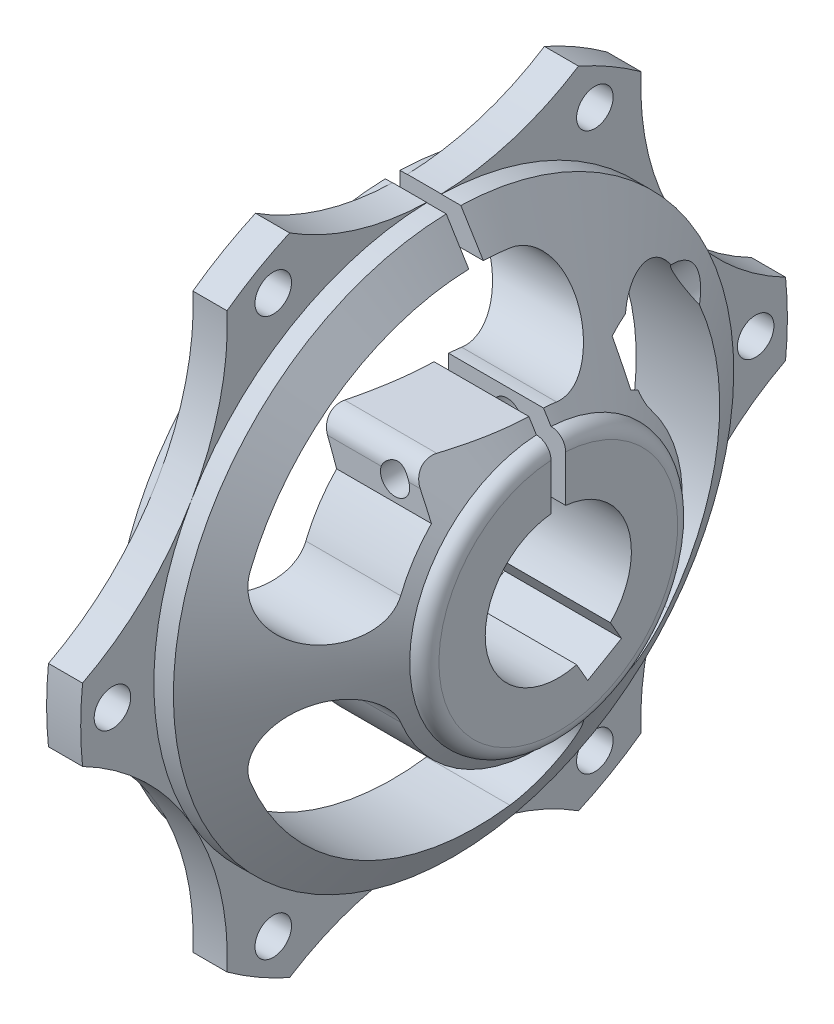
SolidWorks part; units mm, degrees
ref_plane "Face" through (0, 0, 0) normal (0, 0, 1) x (1, 0, 0)
ref_plane "Dessus" through (0, 0, 0) normal (0, 1, 0) x (1, 0, 0)
ref_plane "Droite" through (0, 0, 0) normal (1, 0, 0) x (0, 0, -1)
sketch "Esquisse1" plane through (0, 0, 0) normal (0, 0, 1) x (1, 0, 0)
  line L0 (21.0705, 15) -> (21.0705, 27.5)
  line L1 (21.0705, 27.5) -> (18.0705, 27.5)
  line L2 (18.0705, 27.5) -> (-0.4295, 57.5)
  line L3 (-0.4295, 57.5) -> (-4.4295, 57.5)
  line L4 (-4.4295, 57.5) -> (-4.4295, 72.5136)
  line L5 (-4.4295, 72.5136) -> (-11.4295, 72.5136)
  line L6 (-12.9295, 57.5) -> (-12.9295, 50)
  line L7 (-12.9295, 50) -> (-2.9295, 30)
  line L8 (-2.9295, 30) -> (-2.9295, 15)
  line L9 (-2.9295, 15) -> (21.0705, 15)
  line L10 (-21.9364, 0) -> (19.2429, 0) construction
  line L11 (-11.4295, 72.5136) -> (-11.4295, 57.5)
  line L12 (-12.9295, 57.5) -> (-11.4295, 57.5)
  dimension "D1" = 15
  dimension "D2" = 27.5
  dimension "D3" = 24
  dimension "D4" = 7
  dimension "D5" = 34
  dimension "D6" = 3
  dimension "D7" = 1.5
  dimension "D8" = 4
  dimension "D9" = 57.5
  dimension "D10" = 50
  dimension "D11" = 30
revolve "Révolution1" add sketch "Esquisse1" angle 360 about L10
fillet "Congé1" radius 3
sketch "Esquisse2" plane through (-11.4295, 0, 0) normal (-1, 0, 0) x (0, 0, 1)
  line L0 (-43.7624, 68.2924) -> (-38.6204, 73.3406)
  line L1 (38.6204, 73.3406) -> (43.7323, 68.1574)
  line L2 (78.7745, 4.5098) -> (78.7745, -4.5098)
  line L3 (43.7323, -68.1574) -> (35.0193, -70.0895)
  line L4 (-38.6204, -73.3406) -> (-43.7323, -68.1574)
  line L5 (-78.7745, -4.5098) -> (-78.7745, 4.5098)
  line L6 (0, 0) -> (-44.2733, -76.6836) construction
  line L7 (0, 0) -> (0, 64.3358) construction
  line L8 (-1.5, 57.5205) -> (-1.5, 2.8407)
  line L9 (1.5, 57.5205) -> (1.5, -9.366)
  line L11 (-7.8819, -5.6518) -> (-12.9641, -14.4545)
  line L12 (-12.9641, -14.4545) -> (-6.0359, -18.4545)
  line L13 (-6.0359, -18.4545) -> (-1.3543, -10.3457)
  line L15 (-7.8819, -5.6518) -> (-1.5, 2.8407)
  line L16 (1.5, -9.366) -> (-1.3543, -10.3457)
  arc A0 (-38.6204, 73.3406) -> (-1.5, 57.5205) centre (0, 112.5) ccw
  circle A1 centre (0, 0) radius 57.5 construction
  arc A2 (43.7323, 68.1574) -> (78.7745, 4.5098) centre (97.4279, 56.25) ccw
  arc A3 (78.7745, -4.5098) -> (43.7323, -68.1574) centre (97.4279, -56.25) ccw
  arc A4 (35.0193, -70.0895) -> (-38.6204, -73.3406) centre (0, -112.5) ccw
  arc A5 (-43.7323, -68.1574) -> (-78.7745, -4.5098) centre (-97.4279, -56.25) ccw
  arc A6 (-78.7745, 4.5098) -> (-43.7624, 68.2924) centre (-97.4279, 56.25) ccw
  arc A7 (1.5, 57.5205) -> (38.6204, 73.3406) centre (0, 112.5) ccw
  circle A8 centre (-33, -57.1577) radius 3.75
  circle A9 centre (-66, 0) radius 3.75
  circle A10 centre (-33, 57.1577) radius 3.75
  circle A11 centre (33, 57.1577) radius 3.75
  circle A12 centre (66, 0) radius 3.75
  circle A13 centre (33, -57.1577) radius 3.75
  dimension "D1" = 110
  dimension "D8" = 7.5
  dimension "D2" = 150
  dimension "D3" = 1.5
  dimension "D4" = 4
  dimension "D5" = 8
  dimension "D6" = 19
  dimension "D7" = 3
  dimension "D9" = 66
extrude "Enlèv. mat.-Extru.2" cut sketch "Esquisse2" against normal mid plane 70 flip side to cut
sketch "Esquisse4" plane through (-11.4295, 0, 0) normal (-1, 0, 0) x (0, 0, 1)
  line L1 (-32.8668, -56.9269) -> (0, 0) construction
  line L2 (-33, 57.1577) -> (0, 0) construction
  line L3 (1.5, 29.9625) -> (17.5, 29.9625)
  line L4 (21.5, 25.9625) -> (21.5, 20.9225)
  arc A0 (-6.9376, 49.5164) -> (-4.1626, 29.7098) centre (-5.5501, 39.6131) ccw
  arc A1 (27.8107, 11.25) -> (46.3512, 18.75) centre (37.081, 15) ccw
  arc A2 (46.3512, -18.75) -> (27.8107, -11.25) centre (37.081, -15) ccw
  arc A3 (-4.1626, -29.7098) -> (-6.9376, -49.5164) centre (-5.5501, -39.6131) ccw
  arc A4 (-39.4136, -30.7664) -> (-23.6482, -18.4598) centre (-31.5309, -24.6131) ccw
  arc A5 (-23.6482, 18.4598) -> (-39.4136, 30.7664) centre (-31.5309, 24.6131) ccw
  arc A6 (-23.6482, 18.4598) -> (-23.6482, -18.4598) centre (0, 0) ccw
  arc A7 (-39.4136, 30.7664) -> (-39.4136, -30.7664) centre (0, 0) ccw
  arc A8 (-1.5, 49.9775) -> (1.5, 49.9775) centre (0, 0) ccw construction
  arc A9 (-1.5, 29.9625) -> (1.5, 29.9625) centre (0, 0) ccw construction
  arc A10 (27.8107, 11.25) -> (21.5, 20.9225) centre (0, 0) ccw
  arc A11 (46.3512, 18.75) -> (-6.9376, 49.5164) centre (0, 0) ccw
  arc A12 (-4.1626, -29.7098) -> (27.8107, -11.25) centre (0, 0) ccw
  arc A13 (-6.9376, -49.5164) -> (46.3512, -18.75) centre (0, 0) ccw
  arc A14 (1.5, 29.9625) -> (-4.1626, 29.7098) centre (0, 0) ccw
  arc A15 (21.5, 25.9625) -> (17.5, 29.9625) centre (17.5, 25.9625) ccw
  point P38 (21.5, 29.9625)
  dimension "D2" = 15
  dimension "D8" = 4
  dimension "D1" = 15
  dimension "D3" = 15
  dimension "D4" = 15
  dimension "D5" = 15
  dimension "D6" = 15
  dimension "D7" = 20
extrude "Enlèv. mat.-Extru.5" cut sketch "Esquisse4" against normal mid plane 70
sketch "Esquisse5" plane through (0, 0, 0) normal (0, 0, 1) x (1, 0, 0)
  line L1 (21.0705, -24.5) -> (21.0705, 24.454) construction
  line L3 (16.5288, 0) -> (-2.9295, 0) construction
  circle A0 centre (9.0705, 25) radius 3
  dimension "D1" = 6
  dimension "D2" = 12
  dimension "D3" = 25
extrude "Enlèv. mat.-Extru.6" cut sketch "Esquisse5" against normal mid plane 70
ref_plane "Plan1" through (0, 0, -20) normal (0, 0, 1) x (1, 0, 0)
sketch "Esquisse6" plane through (0, 0, -20) normal (0, 0, 1) x (1, 0, 0)
  circle A0 centre (9.0705, 25) radius 7
  dimension "D1" = 14
extrude "Enlèv. mat.-Extru.7" cut sketch "Esquisse6" against normal blind 70
